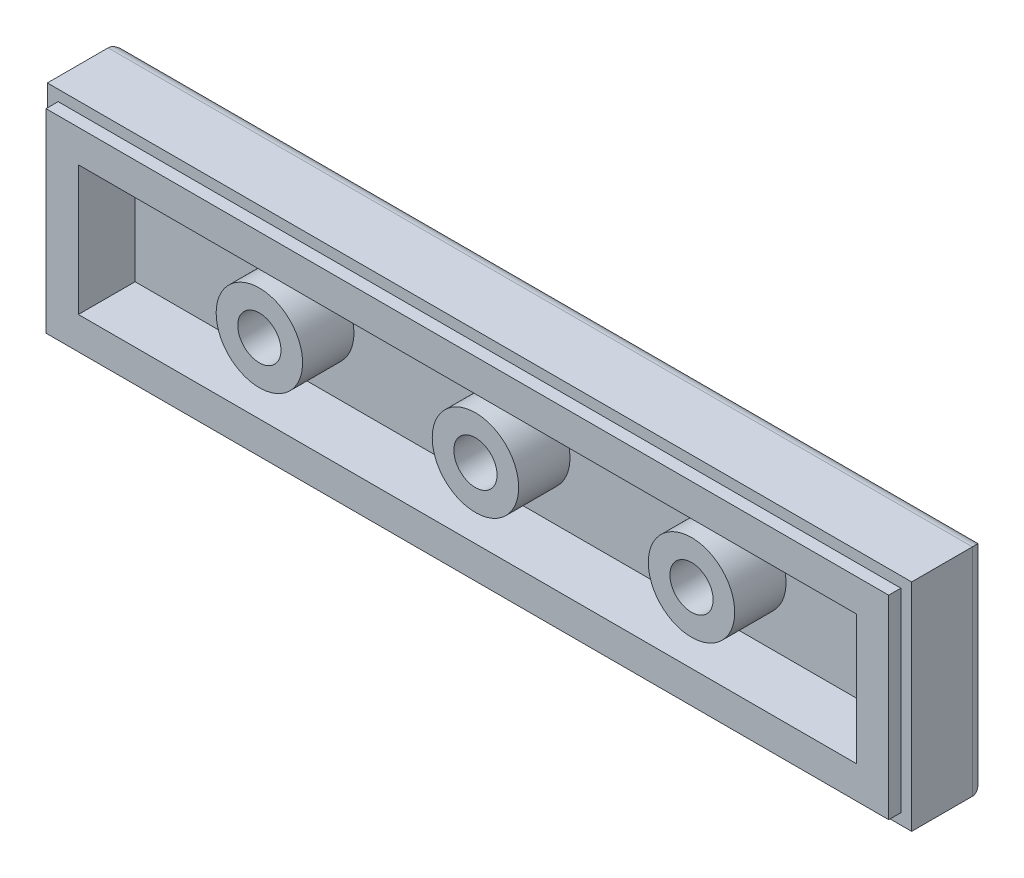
SolidWorks part; units mm, degrees
ref_plane "Vorne" through (0, 0, 0) normal (0, 0, 1) x (1, 0, 0)
ref_plane "Oben" through (0, 0, 0) normal (0, 1, 0) x (1, 0, 0)
ref_plane "Rechts" through (0, 0, 0) normal (1, 0, 0) x (0, 0, -1)
sketch "Skizze1" plane through (0, 0, 0) normal (0, 0, 1) x (1, 0, 0)
  line L1 (0, 0) -> (-32, 0)
  line L2 (0, 0) -> (0, -8)
  line L3 (0, -8) -> (-32, -8)
  line L4 (-32, 0) -> (-32, -8)
  dimension "D1" = 32
  dimension "D2" = 8
extrude "Linear austragen1" add sketch "Skizze1" along normal blind 3.2
sketch "Skizze2" plane through (0, 0, 3.2) normal (0, 0, 1) x (1, 0, 0)
  line L0 (-32, -8) -> (0, -8) construction
  line L1 (-1.6, -6.4) -> (-30.4, -6.4)
  line L2 (-1.6, -6.4) -> (-1.6, -1.6)
  line L3 (-1.6, -1.6) -> (-30.4, -1.6)
  line L4 (-30.4, -6.4) -> (-30.4, -1.6)
  line L5 (0, -8) -> (0, 0) construction
  line L6 (-32, 0) -> (-32, -8) construction
  line L7 (0, 0) -> (-32, 0) construction
  dimension "D1" = 1.6
  dimension "D2" = 1.6
  dimension "D3" = 1.6
  dimension "D4" = 1.6
extrude "Schnitt-Linear austragen1" cut sketch "Skizze2" against normal blind 2.1
sketch "Skizze3" plane through (0, 0, 1.1) normal (0, 0, 1) x (1, 0, 0)
  line L0 (0, -8) -> (0, 0) construction
  line L4 (-30.4, -6.4) -> (-1.6, -6.4) construction
  circle A0 centre (-7.9, -4) radius 1.6
  circle A1 centre (-7.9, -4) radius 0.8
  dimension "D1" = 3.2
  dimension "D2" = 1.6
  dimension "D3" = 7.9
  dimension "D4" = 2.4
extrude "Linear austragen2" add sketch "Skizze3" along normal blind 1.9
pattern_linear "Lineares Muster2" count 3 spacing 8 along (-1, 0, 0) of "Linear austragen2"
sketch "Skizze4" plane through (0, 0, 3.2) normal (0, 0, 1) x (1, 0, 0)
  line L0 (-32, -8) -> (0, -8) construction
  line L1 (-31.6, -0.4) -> (-0.4, -0.4)
  line L2 (-31.6, -0.4) -> (-31.6, -7.6)
  line L3 (-31.6, -7.6) -> (-0.4, -7.6)
  line L4 (-0.4, -0.4) -> (-0.4, -7.6)
  line L5 (0, -8) -> (0, 0) construction
  line L6 (0, 0) -> (-32, 0) construction
  line L7 (-32, 0) -> (-32, -8) construction
  point P10 (-32, -4)
  dimension "D1" = 0.4
  dimension "D2" = 0.4
  dimension "D3" = 0.4
  dimension "D4" = 0.4
extrude "Schnitt-Linear austragen2" cut sketch "Skizze4" against normal blind 0.45 flip side to cut
fillet "Verrundung1" radius 0.5 4 edges at (-16, -8, 0) (-32, -4, 0) (-16, 0, 0) (0, -4, 0)
sketch "Skizze5" plane through (0, 0, 0) normal (0, 0, -1) x (-1, 0, 0)
  line L0 (1.7836, -5.9343) -> (38.912, -5.9343) construction
  text T0 "info@fbz-garbsen.de" font "SWIsop1" height in points 9
extrude "Linear austragen4" add sketch "Skizze5" along normal blind 0.1
